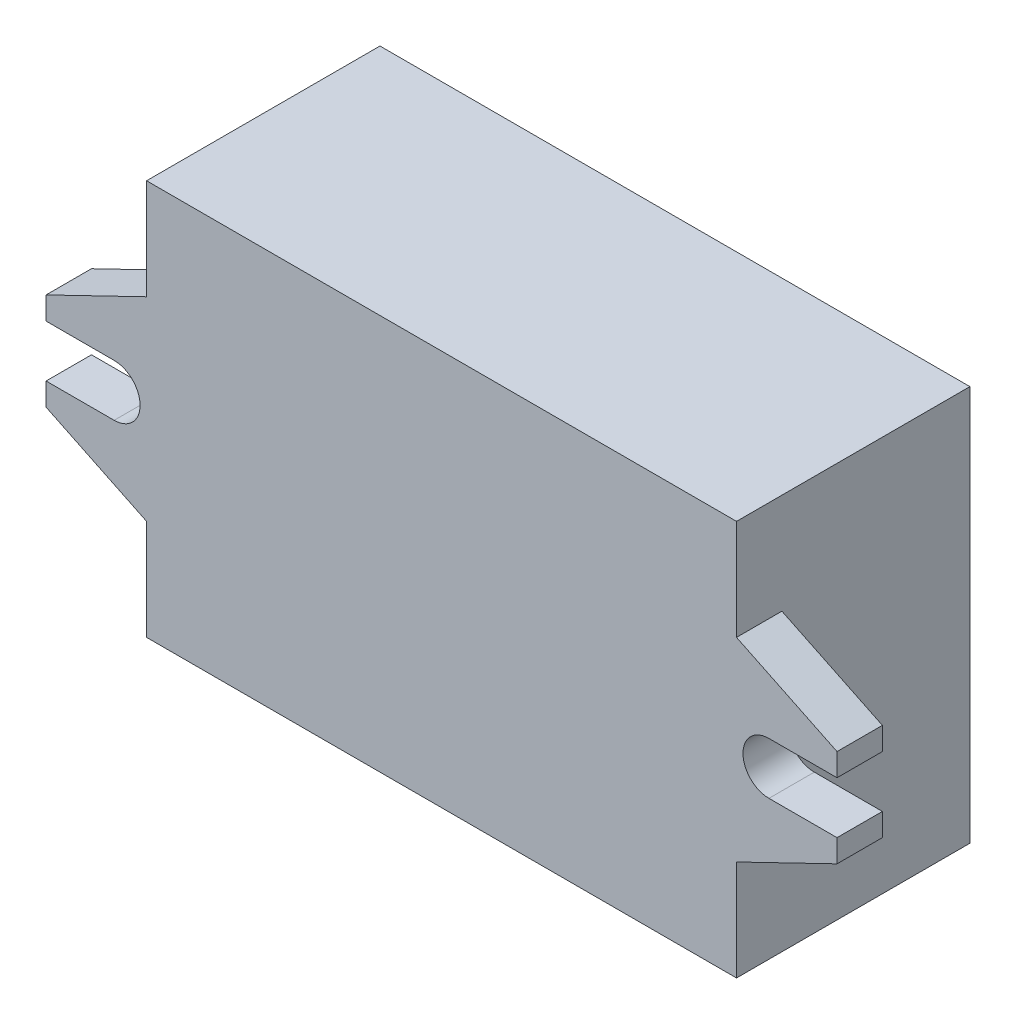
SolidWorks part; units mm, degrees
ref_plane "Front Plane" through (0, 0, 0) normal (0, 0, 1) x (1, 0, 0)
ref_plane "Top Plane" through (0, 0, 0) normal (0, 1, 0) x (1, 0, 0)
ref_plane "Right Plane" through (0, 0, 0) normal (1, 0, 0) x (0, 0, -1)
sketch "Sketch1" plane through (0, 0, 0) normal (0, 0, 1) x (1, 0, 0)
  line L1 (0, 30.988) -> (46.228, 30.988)
  line L2 (0, 30.988) -> (0, 0)
  line L3 (0, 0) -> (46.228, 0)
  line L4 (46.228, 30.988) -> (46.228, 0)
  dimension "D1" = 46.228
  dimension "D2" = 30.988
extrude "Boss-Extrude1" add sketch "Sketch1" along normal blind 18.288
sketch "Sketch2" plane through (0, 0, 18.288) normal (0, 0, 1) x (1, 0, 0)
  line L0 (0, 15.494) -> (46.228, 15.494) construction
  line L1 (0, 30.988) -> (0, 0) construction
  line L2 (46.228, 0) -> (46.228, 30.988) construction
  line L3 (46.228, 23.114) -> (54.102, 19.304)
  line L4 (54.102, 19.304) -> (54.102, 17.526)
  line L5 (54.102, 17.526) -> (48.768, 17.526)
  line L6 (46.228, 7.874) -> (54.102, 11.684)
  line L7 (54.102, 11.684) -> (54.102, 13.462)
  line L8 (54.102, 13.462) -> (48.768, 13.462)
  line L9 (46.228, 23.114) -> (46.228, 7.874)
  line L10 (23.114, 15.494) -> (23.114, 30.988) construction
  line L11 (46.228, 30.988) -> (0, 30.988) construction
  line L12 (0, 23.114) -> (0, 7.874)
  line L13 (0, 7.874) -> (-7.874, 11.684)
  line L14 (-7.874, 13.462) -> (-2.54, 13.462)
  line L15 (-7.874, 11.684) -> (-7.874, 13.462)
  line L16 (-7.874, 17.526) -> (-2.54, 17.526)
  line L17 (-7.874, 19.304) -> (-7.874, 17.526)
  line L18 (0, 23.114) -> (-7.874, 19.304)
  arc A0 (46.736, 15.494) -> (48.768, 17.526) centre (48.768, 15.494) cw
  arc A1 (46.736, 15.494) -> (48.768, 13.462) centre (48.768, 15.494) ccw
  arc A2 (-0.508, 15.494) -> (-2.54, 13.462) centre (-2.54, 15.494) cw
  arc A3 (-0.508, 15.494) -> (-2.54, 17.526) centre (-2.54, 15.494) ccw
  dimension "D1" = 4.064
  dimension "D2" = 0.508
  dimension "D3" = 15.24
  dimension "D4" = 7.874
  dimension "D5" = 7.62
extrude "Boss-Extrude2" add sketch "Sketch2" against normal blind 3.556
